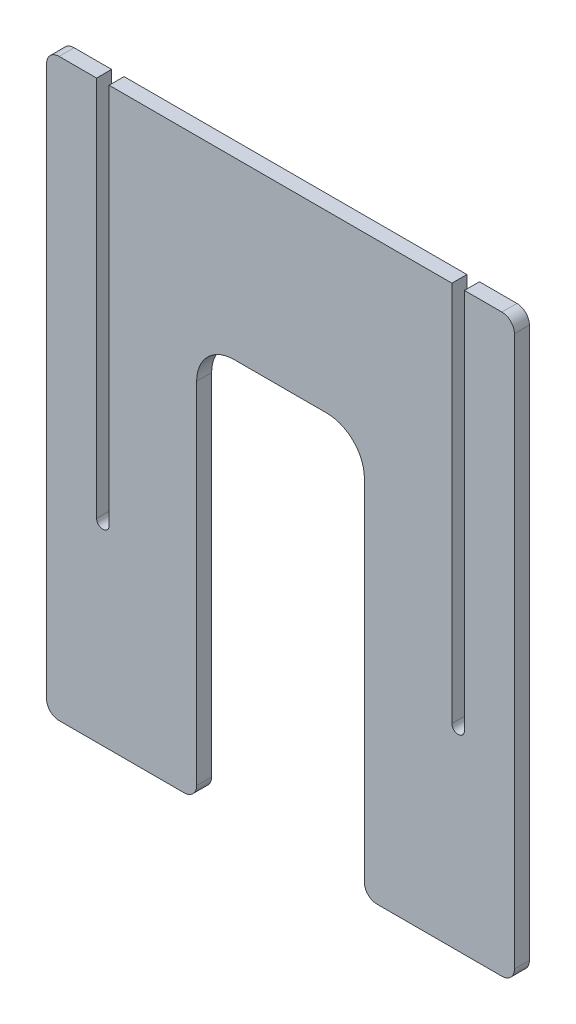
SolidWorks part; units mm, degrees
ref_plane "Front Plane" through (0, 0, 0) normal (0, 0, 1) x (1, 0, 0)
ref_plane "Top Plane" through (0, 0, 0) normal (0, 1, 0) x (1, 0, 0)
ref_plane "Right Plane" through (0, 0, 0) normal (1, 0, 0) x (0, 0, -1)
sketch "Sketch1" plane through (0, 0, 0) normal (0, 0, 1) x (1, 0, 0)
  line L1 (215.8578, 21.5486) -> (255.8578, 21.5486)
  line L2 (-78.2822, 21.5486) -> (-118.2822, 21.5486)
  line L3 (-118.2822, 21.5486) -> (-118.2822, -438.4514)
  line L4 (-118.2822, -438.4514) -> (1.7178, -438.4514)
  line L5 (1.7178, -438.4514) -> (1.7178, -118.4514)
  line L6 (255.8578, 21.5486) -> (255.8578, -438.4514)
  line L7 (255.8578, -438.4514) -> (135.8578, -438.4514)
  line L8 (1.7178, -118.4514) -> (135.8578, -118.4514)
  line L9 (135.8578, -118.4514) -> (135.8578, -438.4514)
  line L10 (-78.2822, 21.5486) -> (-78.2822, -283.4514)
  line L11 (-78.2822, 36.5391) -> (-68.2822, 36.5391)
  line L12 (-68.2822, 21.5486) -> (-68.2822, -283.4514)
  line L13 (215.8578, 21.5486) -> (215.8578, -283.4514)
  line L14 (205.8578, 21.5486) -> (205.8578, -283.4514)
  line L15 (205.8578, 21.5486) -> (-68.2822, 21.5486)
  arc A0 (-78.2822, -283.4514) -> (-68.2822, -283.4514) centre (-73.2822, -283.4514) ccw
  arc A1 (205.8578, -283.4514) -> (215.8578, -283.4514) centre (210.8578, -283.4514) ccw
extrude "Boss-Extrude2" add sketch "Sketch1" along normal blind 12 contours A1 L14 L15 L12 A0 L10 L2 L3 L4 L5 L8 L9 L7 L6 L1 L13
fillet "Fillet3" radius 10 6 edges at (-118.2822, 21.5486, 6) (-118.2822, -438.4514, 6) (135.8578, -438.4514, 6) (1.7178, -438.4514, 6) (255.8578, -438.4514, 6) (255.8578, 21.5486, 6)
fillet "Fillet4" radius 30 2 edges at (135.8578, -118.4514, 6) (1.7178, -118.4514, 6)
